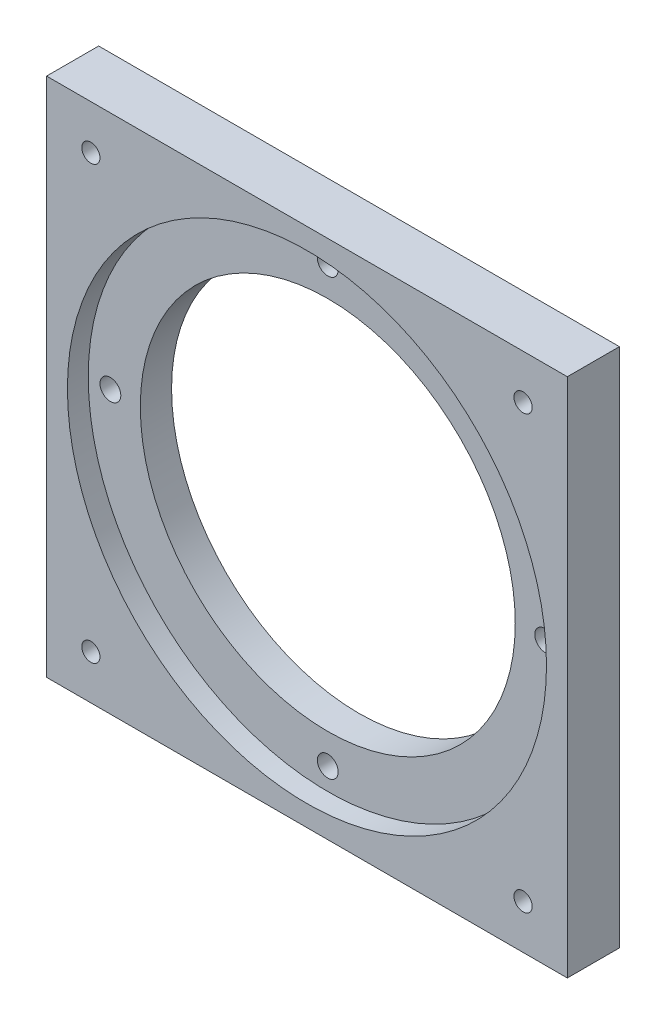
SolidWorks part; units mm, degrees
ref_plane "Спереди" through (0, 0, 0) normal (0, 0, 1) x (1, 0, 0)
ref_plane "Сверху" through (0, 0, 0) normal (0, 1, 0) x (1, 0, 0)
ref_plane "Справа" through (0, 0, 0) normal (1, 0, 0) x (0, 0, -1)
sketch "Эскиз1" plane through (0, 0, 0) normal (0, 0, 1) x (1, 0, 0)
  line L1 (0, 0) -> (100, 0)
  line L2 (0, 0) -> (0, 100)
  line L3 (0, 100) -> (100, 100)
  line L4 (100, 0) -> (100, 100)
  circle A0 centre (50, 50) radius 36
  point P5 (50, 50)
extrude "Бобышка-Вытянуть1" add sketch "Эскиз1" along normal blind 10
sketch "Эскиз2" plane through (0, 0, 10) normal (0, 0, 1) x (1, 0, 0)
  circle A0 centre (50, 50) radius 46
  point P0 (50, 50)
extrude "Вырез-Вытянуть1" cut sketch "Эскиз2" against normal blind 4
sketch "Эскиз3" plane through (0, 0, 6) normal (0, 0, 1) x (1, 0, 0)
  circle A0 centre (50, 50) radius 41.75 construction
  circle A1 centre (8.25, 50) radius 2
  circle A2 centre (50, 91.75) radius 2
  circle A3 centre (91.75, 50) radius 2
  circle A4 centre (50, 8.25) radius 2
extrude "Вырез-Вытянуть2" cut sketch "Эскиз3" against normal through all
sketch "Эскиз4" plane through (0, 0, 10) normal (0, 0, 1) x (1, 0, 0)
  line L0 (50, 100) -> (50, 0) construction
  line L1 (100, 100) -> (0, 100) construction
  line L2 (0, 0) -> (100, 0) construction
  line L3 (0, 50) -> (100, 50) construction
  line L4 (0, 100) -> (0, 0) construction
  line L5 (100, 0) -> (100, 100) construction
  line L6 (8.5, 100) -> (8.5, 0) construction
  line L7 (91.5, 100) -> (91.5, 0) construction
  line L8 (0, 91.5) -> (100, 91.5) construction
  line L9 (0, 8.5) -> (100, 8.5) construction
  circle A0 centre (8.5, 91.5) radius 1.75
  circle A1 centre (91.5, 91.5) radius 1.75
  circle A2 centre (8.5, 8.5) radius 1.75
  circle A3 centre (91.5, 8.5) radius 1.75
  point P0 (50, 50)
  dimension "D1" = 8.5
  dimension "D2" = 8.5
  dimension "D3" = 8.5
  dimension "D4" = 8.5
extrude "Вырез-Вытянуть3" cut sketch "Эскиз4" against normal blind 8
